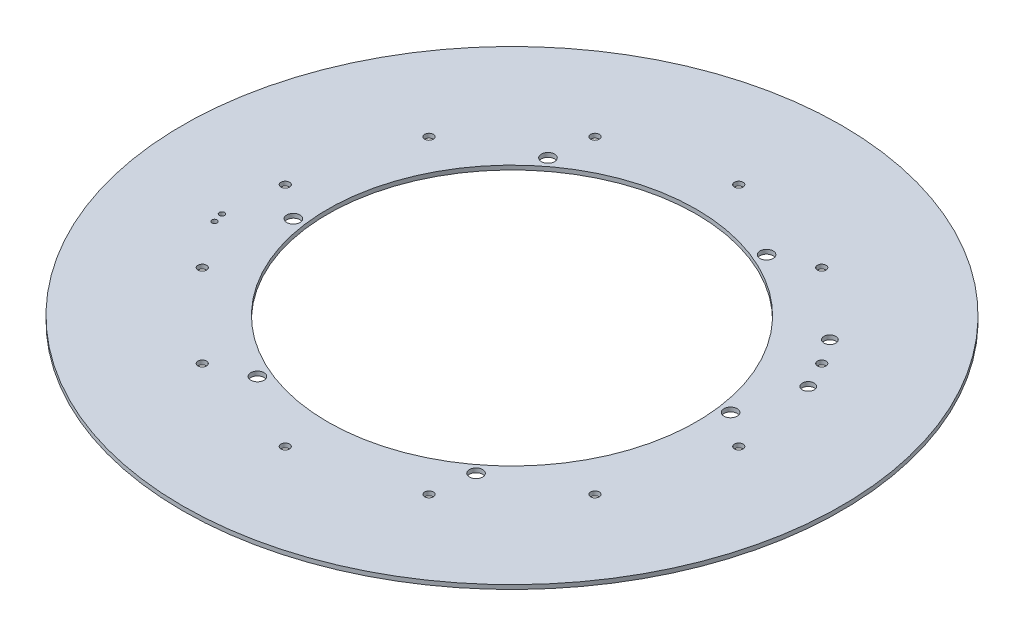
SolidWorks part; units mm, degrees
ref_plane "Front Plane" through (0, 0, 0) normal (0, 0, 1) x (1, 0, 0)
ref_plane "Top Plane" through (0, 0, 0) normal (0, 1, 0) x (1, 0, 0)
ref_plane "Right Plane" through (0, 0, 0) normal (1, 0, 0) x (0, 0, -1)
sketch "Sketch1" plane through (0, 0, 0) normal (0, 1, 0) x (1, 0, 0)
  circle A0 centre (0, 0) radius 125
  circle A1 centre (0, 0) radius 69.9
  dimension "D1" = 250
  dimension "D2" = 139.8
extrude "Boss-Extrude1" add sketch "Sketch1" along normal blind 1.6
hole_wizard "#4 Clearance Hole1" positions "Sketch2" profile "Sketch3" hole size "#4" standard "ANSI Inch"
sketch "Sketch2" plane through (0, 1.6, 0) normal (0, 1, 0) x (1, 0, 0)
  line L0 (0, 0) -> (86, 0) construction
  line L2 (0, 0) -> (74.4782, 43) construction
  line L4 (0, 0) -> (-74.4782, -43) construction
  point P0 (86, 0)
  point P12 (74.4782, -43)
  point P13 (43, -74.4782)
  point P14 (0, -86)
  point P15 (-43, -74.4782)
  point P16 (-74.4782, -43)
  point P17 (-86, 0)
  point P18 (-74.4782, 43)
  point P19 (-43, 74.4782)
  point P20 (0, 86)
  point P21 (43, 74.4782)
  point P22 (74.4782, 43)
  dimension "D1" = 86
  dimension "D2" = 12
sketch "Sketch3" plane through (86, 1.6, 0) normal (1, 0, 0) x (0, 0, 1)
  line L0 (0, 0) -> (0, 1.6)
  line L1 (0, 1.6) -> (1.6319, 1.6)
  line L2 (1.6319, 1.6) -> (1.6319, 0)
  line L5 (1.6319, 0) -> (0, 0)
  line L11 (0, -6.35) -> (0, 107.95) construction
  dimension "Thru Hole Dia." = 3.2639
  dimension "Thru Hole Depth" = 1.6
hole_wizard "Ø5.0mm Dowel Hole1" positions "Sketch4" profile "Sketch5" hole size "Ø5.0" standard "ANSI Metric"
sketch "Sketch4" plane through (0, 1.6, 0) normal (0, 1, 0) x (1, 0, 0)
  line L0 (0, 0) -> (73.2678, 9.6459) construction
  line L2 (0, 0) -> (58.0524, 0) construction
  line L3 (0, 0) -> (28.2803, 68.2747) construction
  line L5 (0, 0) -> (-28.2803, -68.2747) construction
  point P0 (73.2678, 9.6459)
  point P20 (44.9875, -58.6288)
  point P21 (-28.2803, -68.2747)
  point P22 (-73.2678, -9.6459)
  point P29 (-44.9875, 58.6288)
  point P30 (28.2803, 68.2747)
  dimension "D1" = 7.5
  dimension "D2" = 73.9
  dimension "D3" = 6
sketch "Sketch5" plane through (73.2678, 1.6, -9.6459) normal (1, 0, 0) x (0, 0, 1)
  line L0 (0, 0) -> (0, 1.6)
  line L1 (0, 1.6) -> (2.5, 1.6)
  line L2 (2.5, 1.6) -> (2.5, 0)
  line L5 (2.5, 0) -> (0, 0)
  line L11 (0, -6.35) -> (0, 107.95) construction
  dimension "Thru Hole Dia." = 5
  dimension "Thru Hole Depth" = 1.6
hole_wizard "#8 Clearance Hole1" positions "Sketch6" profile "Sketch7" hole size "#8" standard "ANSI Inch"
sketch "Sketch6" plane through (0, 1.6, 0) normal (0, 1, 0) x (1, 0, 0)
  line L0 (0, 0) -> (79.4536, 32.9108) construction
  line L2 (0, 0) -> (86, 0) construction
  line L3 (0, 0) -> (68.2284, 52.3535) construction
  point P0 (79.4536, 32.9108)
  point P12 (68.2284, 52.3535)
  dimension "D1" = 22.5
  dimension "D2" = 15
sketch "Sketch7" plane through (79.4536, 1.6, -32.9108) normal (1, 0, 0) x (0, 0, 1)
  line L0 (0, 0) -> (0, 1.6)
  line L1 (0, 1.6) -> (2.2479, 1.6)
  line L2 (2.2479, 1.6) -> (2.2479, 0)
  line L5 (2.2479, 0) -> (0, 0)
  line L11 (0, -6.35) -> (0, 107.95) construction
  dimension "Thru Hole Dia." = 4.4958
  dimension "Thru Hole Depth" = 1.6
hole_wizard "Ø2.0mm Dowel Hole1" positions "Sketch8" profile "Sketch9" hole size "Ø2.0" standard "ANSI Metric"
sketch "Sketch8" plane through (0, 1.6, 0) normal (0, 1, 0) x (1, 0, 0)
  line L0 (-88.3957, -21.615) -> (0, 0) construction
  line L1 (0, 0) -> (-87.3604, -25.4787) construction
  line L3 (0, 0) -> (-61.5609, 0) construction
  line L5 (-88.3957, -21.615) -> (-87.3604, -25.4787) construction
  line L7 (-87.878, -23.5468) -> (0, 0) construction
  point P0 (-88.3957, -21.615)
  point P2 (-87.3604, -25.4787)
  dimension "D1" = 91
  dimension "D2" = 15
  dimension "D3" = 4
sketch "Sketch9" plane through (-88.3957, 1.6, 21.615) normal (1, 0, 0) x (0, 0, 1)
  line L0 (0, 0) -> (0, 1.6)
  line L1 (0, 1.6) -> (1, 1.6)
  line L2 (1, 1.6) -> (1, 0)
  line L5 (1, 0) -> (0, 0)
  line L11 (0, -6.35) -> (0, 107.95) construction
  dimension "Thru Hole Dia." = 2
  dimension "Thru Hole Depth" = 1.6
